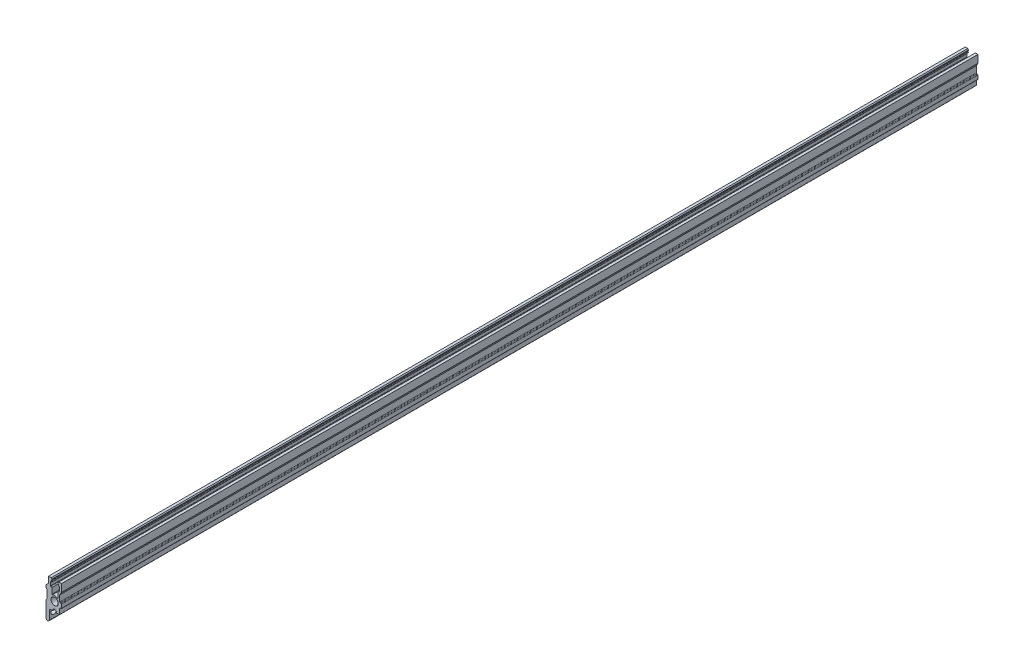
SolidWorks part; units mm, degrees
ref_plane "前视基准面" through (0, 0, 0) normal (0, 0, 1) x (1, 0, 0)
ref_plane "上视基准面" through (0, 0, 0) normal (0, 1, 0) x (1, 0, 0)
ref_plane "右视基准面" through (0, 0, 0) normal (1, 0, 0) x (0, 0, -1)
sketch "草图1" plane through (0, 0, 0) normal (0, 0, 1) x (1, 0, 0)
  line L0 (-2.3509, 8.9116) -> (-2.3509, 6.6116)
  line L1 (-2.3509, 8.9116) -> (-1.4509, 8.9116)
  line L2 (-1.4509, 8.9116) -> (-1.4509, 11.7916)
  line L3 (-1.4509, 11.7916) -> (-4.1259, 11.7916)
  line L4 (-4.1259, 11.7916) -> (-4.1259, 10.0616)
  line L5 (-4.1259, 10.0616) -> (-3.5009, 9.8916)
  line L6 (-3.5009, 9.8916) -> (-3.5009, 8.5216)
  line L7 (-3.5009, 8.5216) -> (-5.0009, 8.5216)
  line L8 (-5.0009, 8.5216) -> (-5.0009, 4.4416)
  line L9 (-5.0009, 4.4416) -> (-4.5507, 3.9414)
  line L10 (-4.5507, 3.9414) -> (-4.551, -1.0586)
  line L11 (-4.551, -1.0586) -> (-5.0009, -1.5584)
  line L12 (-5.0009, -1.5584) -> (-5.0009, -10.75)
  line L13 (-3.0009, -10.75) -> (-3.0009, -5.75)
  line L14 (2.9991, -5.05) -> (2.9991, -2.0584)
  line L15 (3.2991, -1.7584) -> (3.6991, -1.7584)
  line L16 (3.9991, -2.0584) -> (3.9991, -3.4584) construction
  line L17 (4.2991, -3.7584) -> (4.6991, -3.7584) construction
  line L18 (4.9991, -3.4584) -> (4.9991, 2.6416) construction
  line L19 (4.6991, 2.9416) -> (4.2991, 2.9416) construction
  line L20 (3.9991, 2.6416) -> (3.9991, 1.2416) construction
  line L21 (3.6991, 0.9416) -> (3.2991, 0.9416)
  line L22 (2.9991, 1.2416) -> (2.9991, 4.8054)
  line L23 (2.9991, 4.8054) -> (3.9991, 6.5374)
  line L24 (3.9991, 6.5374) -> (3.9991, 9.5216)
  line L25 (3.9991, 9.5216) -> (3.1241, 9.5216)
  line L26 (3.1241, 10.7916) -> (3.1241, 11.7916)
  line L27 (3.1241, 11.7916) -> (1.9491, 11.7916)
  line L28 (1.9491, 11.7916) -> (1.9491, 8.9116)
  line L29 (1.9491, 8.9116) -> (2.8491, 8.9116)
  line L30 (2.8491, 6.6116) -> (2.8491, 8.9116)
  line L31 (2.8491, 6.6116) -> (1.9491, 6.6116)
  line L32 (1.9491, 6.6116) -> (1.9491, 2.6797)
  line L33 (-1.4509, 2.9454) -> (-1.4509, 6.6116)
  line L34 (-1.4509, 6.6116) -> (-2.3509, 6.6116)
  line L35 (0, 0) -> (0, -5) construction
  line L36 (-1.05, -5) -> (-1.05, -5.15)
  line L37 (1.05, -5) -> (1.05, -5.15)
  line L38 (1.15, -5.25) -> (2.7991, -5.25)
  line L39 (-2.5009, -5.25) -> (-1.15, -5.25)
  line L40 (-1.4509, 10.3516) -> (1.9491, 10.3516) construction
  line L41 (-3.0009, -10.75) -> (-5.0009, -10.75) construction
  line L42 (0.2491, 10.3516) -> (0.2491, 6.8507) construction
  line L44 (3.9991, 0.6416) -> (3.9991, -1.4584)
  arc A0 (-5.0009, -10.75) -> (-3.0009, -10.75) centre (-4.0009, -10.75) ccw
  arc A1 (3.2991, -1.7584) -> (2.9991, -2.0584) centre (3.2991, -2.0584) ccw
  arc A2 (3.9991, -2.0584) -> (3.6991, -1.7584) centre (3.6991, -2.0584) ccw construction
  arc A3 (3.9991, -3.4584) -> (4.2991, -3.7584) centre (4.2991, -3.4584) ccw construction
  arc A4 (4.6991, -3.7584) -> (4.9991, -3.4584) centre (4.6991, -3.4584) ccw construction
  arc A5 (4.9991, 2.6416) -> (4.6991, 2.9416) centre (4.6991, 2.6416) ccw construction
  arc A6 (4.2991, 2.9416) -> (3.9991, 2.6416) centre (4.2991, 2.6416) ccw construction
  arc A7 (3.6991, 0.9416) -> (3.9991, 1.2416) centre (3.6991, 1.2416) ccw construction
  arc A8 (2.9991, 1.2416) -> (3.2991, 0.9416) centre (3.2991, 1.2416) ccw
  arc A9 (3.1241, 10.7916) -> (3.1241, 9.5216) centre (3.1841, 10.1566) ccw
  circle A10 centre (0, 0) radius 1.6
  arc A11 (1.6398, 2.5122) -> (-1.1727, 2.7613) centre (0, 0) ccw
  arc A12 (1.6398, 2.5122) -> (1.9491, 2.6797) centre (1.7491, 2.6797) ccw
  arc A13 (-1.4509, 2.9454) -> (-1.1727, 2.7613) centre (-1.2509, 2.9454) ccw
  arc A14 (1.05, -5) -> (-1.05, -5) centre (0, -5) ccw
  arc A15 (1.15, -5.25) -> (1.05, -5.15) centre (1.15, -5.15) cw
  arc A16 (-1.05, -5.15) -> (-1.15, -5.25) centre (-1.15, -5.15) cw
  arc A17 (3.6991, 0.9416) -> (3.9991, 0.6416) centre (3.6991, 0.6416) cw
  arc A18 (3.9991, -1.4584) -> (3.6991, -1.7584) centre (3.6991, -1.4584) cw
  arc A19 (2.7991, -5.25) -> (2.9991, -5.05) centre (2.7991, -5.05) ccw
  arc A20 (-3.0009, -5.75) -> (-2.5009, -5.25) centre (-2.5009, -5.75) cw
  point P72 (1.05, -5.25)
  dimension "D1" = 2.1
  dimension "D3" = 5
  dimension "D4" = 0.1
  dimension "D6" = 0.3
  dimension "D2" = 10.75
  dimension "D5" = 5.2
extrude "凸台-拉伸1" add sketch "草图1" along normal mid plane 533.4
sketch "草图9" plane through (0, 0, -266.7) normal (0, 0, -1) x (-1, 0, 0)
  line L0 (2.3509, 8.9116) -> (1.4509, 8.9116) construction
  line L1 (2.4509, 8.9116) -> (-2.9491, 8.9116)
  line L2 (2.4509, 8.9116) -> (2.4509, 6.4116)
  line L3 (2.4509, 6.4116) -> (-2.9491, 6.4116)
  line L4 (-2.9491, 8.9116) -> (-2.9491, 6.4116)
  line L5 (2.3509, 6.6116) -> (2.3509, 8.9116) construction
  line L6 (-2.8491, 8.9116) -> (-2.8491, 6.6116) construction
  line L7 (-2.8491, 6.6116) -> (-1.9491, 6.6116) construction
  dimension "D1" = 0.1
  dimension "D2" = 0.1
  dimension "D3" = 0.2
extrude "切除-拉伸7" cut sketch "草图9" against normal through all
fillet "圆角4" radius 0.2 4 edges at (-2.4509, 8.9116, 0) (-2.4509, 6.4116, 0) (2.9491, 8.9116, 0) (2.9491, 6.4116, 0)
sketch "草图2" plane through (0, 0, -266.7) normal (0, 0, -1) x (-1, 0, 0)
  circle A0 centre (0, 0) radius 2.1
  dimension "D1" = 4.2
extrude "切除-拉伸1" cut sketch "草图2" against normal blind 10
sketch "草图3" plane through (0, 0, 266.7) normal (0, 0, 1) x (1, 0, 0)
  circle A0 centre (0, 0) radius 2.1
  dimension "D1" = 4.2
extrude "切除-拉伸2" cut sketch "草图3" against normal blind 10
sketch "草图4" plane through (-5.0009, 0, 0) normal (-1, 0, 0) x (0, 0, 1)
  line L0 (-266.7, -1.5584) -> (-266.7, -10.75) construction
  line L1 (-266.7, -11.75) -> (266.7, -11.75) construction
  circle A0 centre (-264.16, -7.5) radius 1.65
  circle A1 centre (-259.08, -7.5) radius 1.65
  circle A2 centre (-254, -7.5) radius 1.65
  circle A3 centre (-248.92, -7.5) radius 1.65
  circle A4 centre (-243.84, -7.5) radius 1.65
  circle A5 centre (-238.76, -7.5) radius 1.65
  circle A6 centre (-233.68, -7.5) radius 1.65
  circle A7 centre (-228.6, -7.5) radius 1.65
  circle A8 centre (-223.52, -7.5) radius 1.65
  circle A9 centre (-218.44, -7.5) radius 1.65
  circle A10 centre (-213.36, -7.5) radius 1.65
  circle A11 centre (-208.28, -7.5) radius 1.65
  circle A12 centre (-203.2, -7.5) radius 1.65
  circle A13 centre (-198.12, -7.5) radius 1.65
  circle A14 centre (-193.04, -7.5) radius 1.65
  circle A15 centre (-187.96, -7.5) radius 1.65
  circle A16 centre (-182.88, -7.5) radius 1.65
  circle A17 centre (-177.8, -7.5) radius 1.65
  circle A18 centre (-172.72, -7.5) radius 1.65
  circle A19 centre (-167.64, -7.5) radius 1.65
  circle A20 centre (-162.56, -7.5) radius 1.65
  circle A21 centre (-157.48, -7.5) radius 1.65
  circle A22 centre (-152.4, -7.5) radius 1.65
  circle A23 centre (-147.32, -7.5) radius 1.65
  circle A24 centre (-142.24, -7.5) radius 1.65
  circle A25 centre (-137.16, -7.5) radius 1.65
  circle A26 centre (-132.08, -7.5) radius 1.65
  circle A27 centre (-127, -7.5) radius 1.65
  circle A28 centre (-121.92, -7.5) radius 1.65
  circle A29 centre (-116.84, -7.5) radius 1.65
  circle A30 centre (-111.76, -7.5) radius 1.65
  circle A31 centre (-106.68, -7.5) radius 1.65
  circle A32 centre (-101.6, -7.5) radius 1.65
  circle A33 centre (-96.52, -7.5) radius 1.65
  circle A34 centre (-91.44, -7.5) radius 1.65
  circle A35 centre (-86.36, -7.5) radius 1.65
  circle A36 centre (-81.28, -7.5) radius 1.65
  circle A37 centre (-76.2, -7.5) radius 1.65
  circle A38 centre (-71.12, -7.5) radius 1.65
  circle A39 centre (-66.04, -7.5) radius 1.65
  circle A40 centre (-60.96, -7.5) radius 1.65
  circle A41 centre (-55.88, -7.5) radius 1.65
  circle A42 centre (-50.8, -7.5) radius 1.65
  circle A43 centre (-45.72, -7.5) radius 1.65
  circle A44 centre (-40.64, -7.5) radius 1.65
  circle A45 centre (-35.56, -7.5) radius 1.65
  circle A46 centre (-30.48, -7.5) radius 1.65
  circle A47 centre (-25.4, -7.5) radius 1.65
  circle A48 centre (-20.32, -7.5) radius 1.65
  circle A49 centre (-15.24, -7.5) radius 1.65
  circle A50 centre (-10.16, -7.5) radius 1.65
  circle A51 centre (-5.08, -7.5) radius 1.65
  circle A52 centre (0, -7.5) radius 1.65
  circle A53 centre (5.08, -7.5) radius 1.65
  circle A54 centre (10.16, -7.5) radius 1.65
  circle A55 centre (15.24, -7.5) radius 1.65
  circle A56 centre (20.32, -7.5) radius 1.65
  circle A57 centre (25.4, -7.5) radius 1.65
  circle A58 centre (30.48, -7.5) radius 1.65
  circle A59 centre (35.56, -7.5) radius 1.65
  circle A60 centre (40.64, -7.5) radius 1.65
  circle A61 centre (45.72, -7.5) radius 1.65
  circle A62 centre (50.8, -7.5) radius 1.65
  circle A63 centre (55.88, -7.5) radius 1.65
  circle A64 centre (60.96, -7.5) radius 1.65
  circle A65 centre (66.04, -7.5) radius 1.65
  circle A66 centre (71.12, -7.5) radius 1.65
  circle A67 centre (76.2, -7.5) radius 1.65
  circle A68 centre (81.28, -7.5) radius 1.65
  circle A69 centre (86.36, -7.5) radius 1.65
  circle A70 centre (91.44, -7.5) radius 1.65
  circle A71 centre (96.52, -7.5) radius 1.65
  circle A72 centre (101.6, -7.5) radius 1.65
  circle A73 centre (106.68, -7.5) radius 1.65
  circle A74 centre (111.76, -7.5) radius 1.65
  circle A75 centre (116.84, -7.5) radius 1.65
  circle A76 centre (121.92, -7.5) radius 1.65
  circle A77 centre (127, -7.5) radius 1.65
  circle A78 centre (132.08, -7.5) radius 1.65
  circle A79 centre (137.16, -7.5) radius 1.65
  circle A80 centre (142.24, -7.5) radius 1.65
  circle A81 centre (147.32, -7.5) radius 1.65
  circle A82 centre (152.4, -7.5) radius 1.65
  circle A83 centre (157.48, -7.5) radius 1.65
  circle A84 centre (162.56, -7.5) radius 1.65
  circle A85 centre (187.96, -7.5) radius 1.65
  circle A86 centre (172.72, -7.5) radius 1.65
  circle A87 centre (203.2, -7.5) radius 1.65
  circle A88 centre (193.04, -7.5) radius 1.65
  circle A89 centre (167.64, -7.5) radius 1.65
  circle A90 centre (208.28, -7.5) radius 1.65
  circle A91 centre (182.88, -7.5) radius 1.65
  circle A92 centre (213.36, -7.5) radius 1.65
  circle A93 centre (177.8, -7.5) radius 1.65
  circle A94 centre (198.12, -7.5) radius 1.65
  circle A95 centre (238.76, -7.5) radius 1.65
  circle A96 centre (223.52, -7.5) radius 1.65
  circle A97 centre (254, -7.5) radius 1.65
  circle A98 centre (243.84, -7.5) radius 1.65
  circle A99 centre (218.44, -7.5) radius 1.65
  circle A100 centre (259.08, -7.5) radius 1.65
  circle A101 centre (233.68, -7.5) radius 1.65
  circle A102 centre (264.16, -7.5) radius 1.65
  circle A103 centre (228.6, -7.5) radius 1.65
  circle A104 centre (248.92, -7.5) radius 1.65
  dimension "D1" = 3.3
  dimension "D5" = 5.08
  dimension "D2" = 2.54
  dimension "D3" = 4.25
  dimension "D4" = 85
extrude "切除-拉伸3" cut sketch "草图4" against normal blind 12
sketch "草图5" plane through (0, 0, 266.7) normal (0, 0, 1) x (1, 0, 0)
  line L0 (1.9491, 8.9116) -> (2.7491, 8.9116) construction
  line L1 (1.9491, 8.9116) -> (3.9991, 8.9116)
  line L2 (1.9491, 8.9116) -> (1.9491, 11.7916)
  line L3 (1.9491, 11.7916) -> (3.9991, 11.7916)
  line L4 (3.9991, 8.9116) -> (3.9991, 11.7916)
  line L5 (3.1241, 11.7916) -> (1.9491, 11.7916) construction
  line L6 (3.9991, 6.5374) -> (3.9991, 9.5216) construction
  line L7 (-1.4509, 11.7916) -> (-4.1259, 11.7916) construction
  line L8 (-5.0009, 8.5216) -> (-2.7884, 8.5216)
  line L9 (-5.0009, 8.5216) -> (-5.0009, 11.7916)
  line L10 (-5.0009, 11.7916) -> (-2.7884, 11.7916)
  line L11 (-2.7884, 8.5216) -> (-2.7884, 11.7916)
extrude "凸台-拉伸2" add sketch "草图5" against normal up to surface (533.4 mm away)
sketch "草图6" plane through (0, 0, -266.7) normal (0, 0, -1) x (-1, 0, 0)
  line L0 (-1.9491, 9.4916) -> (1.4509, 9.4916) construction
  line L1 (-1.9491, 11.7916) -> (-1.9491, 8.9116) construction
  line L2 (1.4509, 8.9116) -> (1.4509, 11.7916) construction
  line L3 (1.4509, 11.7916) -> (5.0009, 11.7916) construction
  line L4 (-2.3491, 8.9916) -> (1.8509, 8.9916)
  line L5 (-2.3491, 8.9916) -> (-2.3491, 9.9916)
  line L6 (-2.3491, 9.9916) -> (1.8509, 9.9916)
  line L7 (1.8509, 8.9916) -> (1.8509, 9.9916)
  line L8 (-2.3491, 8.9916) -> (1.8509, 9.9916) construction
  line L9 (-2.3491, 9.9916) -> (1.8509, 8.9916) construction
  point P6 (-0.2491, 9.4916)
  dimension "D1" = 1
  dimension "D2" = 4.2
  dimension "D3" = 1.8
extrude "切除-拉伸4" cut sketch "草图6" against normal through all
sketch "草图8" plane through (0, 0, -266.7) normal (0, 0, -1) x (-1, 0, 0)
  line L0 (5.0009, 11.7916) -> (5.0009, 4.4416) construction
  line L1 (-3.9991, 11.7916) -> (5.0009, 11.7916)
  line L2 (-3.9991, 11.7916) -> (-3.9991, 11.0016)
  line L3 (-3.9991, 11.0016) -> (5.0009, 11.0016)
  line L4 (5.0009, 11.7916) -> (5.0009, 11.0016)
  dimension "D1" = 0.79
extrude "切除-拉伸6" cut sketch "草图8" against normal through all
fillet "圆角1" radius 0.5 4 edges at (-1.8509, 9.9916, 0) (-1.8509, 8.9916, 0) (2.3491, 9.9916, 0) (2.3491, 8.9916, 0)
chamfer "倒角1" distance 0.5 angle 45 2 edges at (-1.4509, 11.0016, 0) (1.9491, 11.0016, 0)
fillet "圆角2" radius 0.2 6 edges at (1.9491, 10.5016, 0) (-1.4509, 10.5016, 0) (-1.4509, 8.9916, 0) (-1.4509, 9.9916, 0) (1.9491, 8.9916, 0) (1.9491, 9.9916, 0)
fillet "圆角3" radius 0.1 2 edges at (-1.4509, 8.9116, 0) (1.9491, 8.9116, 0)
sketch "草图7" plane through (0, 0, -266.7) normal (0, 0, -1) x (-1, 0, 0)
  line L0 (5.0009, 11.0016) -> (3.5009, 11.0016)
  line L2 (3.5009, 11.0016) -> (3.5009, 7.4416)
  line L3 (3.5009, 7.4416) -> (5.0009, 5.9416)
  line L4 (5.0009, 11.0016) -> (5.0009, 4.4416) construction
  line L5 (5.0009, 5.9416) -> (5.0009, 11.0016)
  line L6 (1.4509, 10.1341) -> (1.4509, 10.4187) construction
  line L7 (1.9509, 11.0016) -> (5.0009, 11.0016) construction
  dimension "D1" = 2.05
  dimension "D2" = 1.5
  dimension "D3" = 45
extrude "切除-拉伸5" cut sketch "草图7" against normal through all
